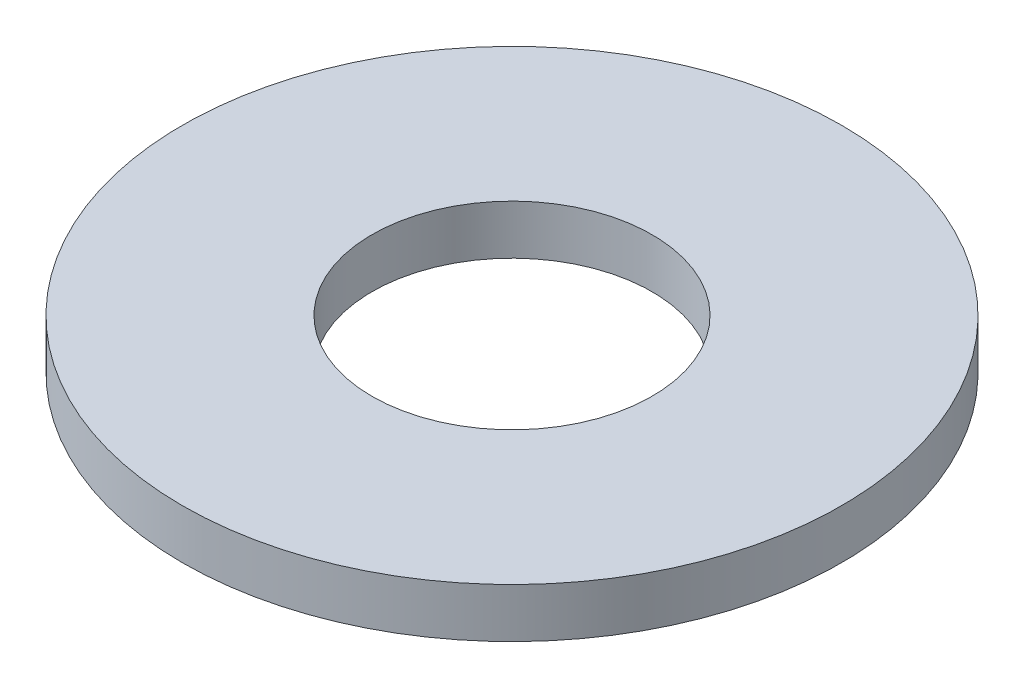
SolidWorks part; units mm, degrees
ref_plane "Front" through (0, 0, 0) normal (0, 0, 1) x (1, 0, 0)
ref_plane "Top" through (0, 0, 0) normal (0, 1, 0) x (1, 0, 0)
ref_plane "Right" through (0, 0, 0) normal (1, 0, 0) x (0, 0, -1)
sketch "Sketch1" plane through (0, 0, 0) normal (0, 1, 0) x (1, 0, 0)
  circle A0 centre (0, 0) radius 0.85
  circle A1 centre (0, 0) radius 2
extrude "Extrude1" add sketch "Sketch1" along normal blind 0.3
